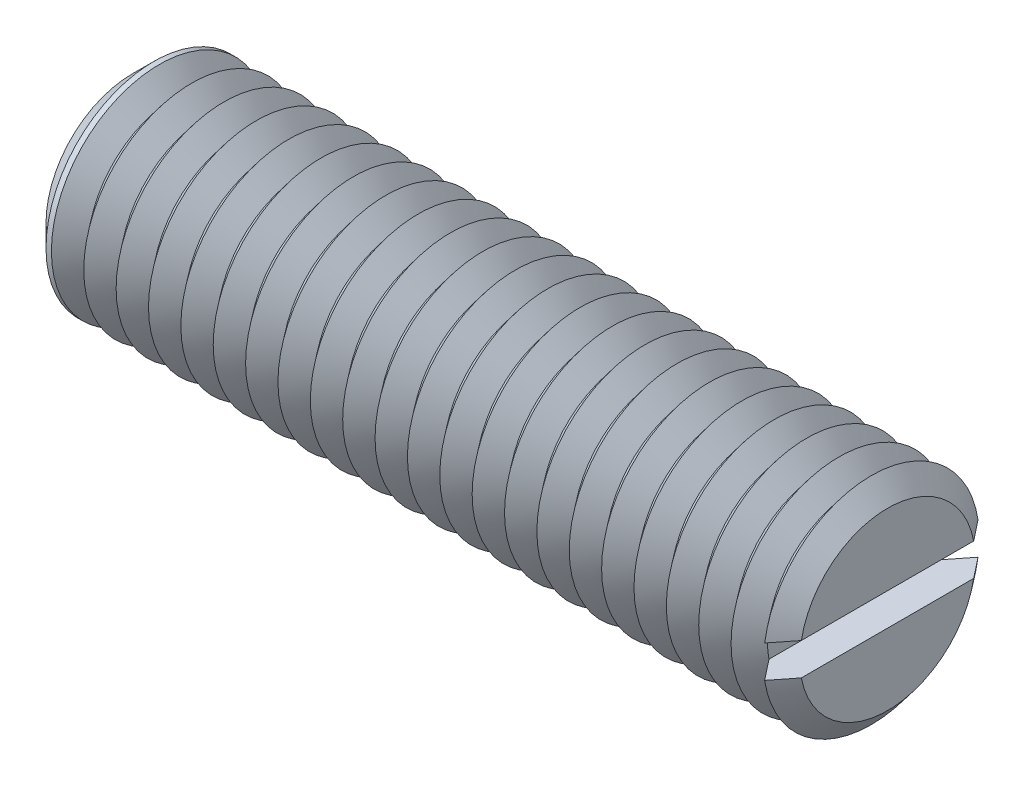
SolidWorks part; units mm, degrees
ref_plane "Front Plane" through (0, 0, 0) normal (0, 0, 1) x (1, 0, 0)
ref_plane "Top Plane" through (0, 0, 0) normal (0, 1, 0) x (1, 0, 0)
ref_plane "Right Plane" through (0, 0, 0) normal (1, 0, 0) x (0, 0, -1)
sketch "Sketch1" plane through (0, 0, 0) normal (1, 0, 0) x (0, 0, -1)
  circle A0 centre (0, 0) radius 5
  dimension "D1" = 10
extrude "Extrude1" add sketch "Sketch1" along normal mid plane 35
sketch "Sketch2" plane through (0, 0, 0) normal (0, 0, 1) x (1, 0, 0)
  line L0 (17.5, 0.75) -> (16, 0.75)
  line L1 (17.5, -5) -> (17.5, 5) construction
  line L2 (16, 0.75) -> (16, -0.75)
  line L3 (0, 0) -> (50000, 0) construction
  line L4 (17.5, -0.75) -> (16, -0.75)
  line L5 (17.5, -0.75) -> (17.5, 0.75)
  point P9 (16, 0)
  dimension "D1" = 1.5
extrude "Extrude2" cut sketch "Sketch2" against normal mid plane 15
chamfer "Chamfer1" distance 1 angle 45 1 edges at (-17.5, 0, -5)
sketch "Sketch3" plane through (0, 0, 0) normal (0, 0, 1) x (1, 0, 0)
  line L0 (0, 0) -> (30.9602, 0) construction
  line L1 (16.75, -5) -> (18.25, -5)
  line L2 (-16.5, -5) -> (17.5, -5) construction
  line L3 (18.25, -5) -> (17.5, -4.0633)
  line L4 (17.5, -5) -> (17.5, -0.75) construction
  line L5 (17.5, -4.0633) -> (16.75, -5)
  dimension "D1" = 1.5
  dimension "D2" = 1.2
revolve "Cut-Revolve1" cut sketch "Sketch3" angle 360 about L0
pattern_linear "LPattern1" count 23 spacing 1.5 along (-1, 0, 0) of "Cut-Revolve1"
equation "\"D2@Sketch3\" = \"D1@Sketch3\"*0.8"
